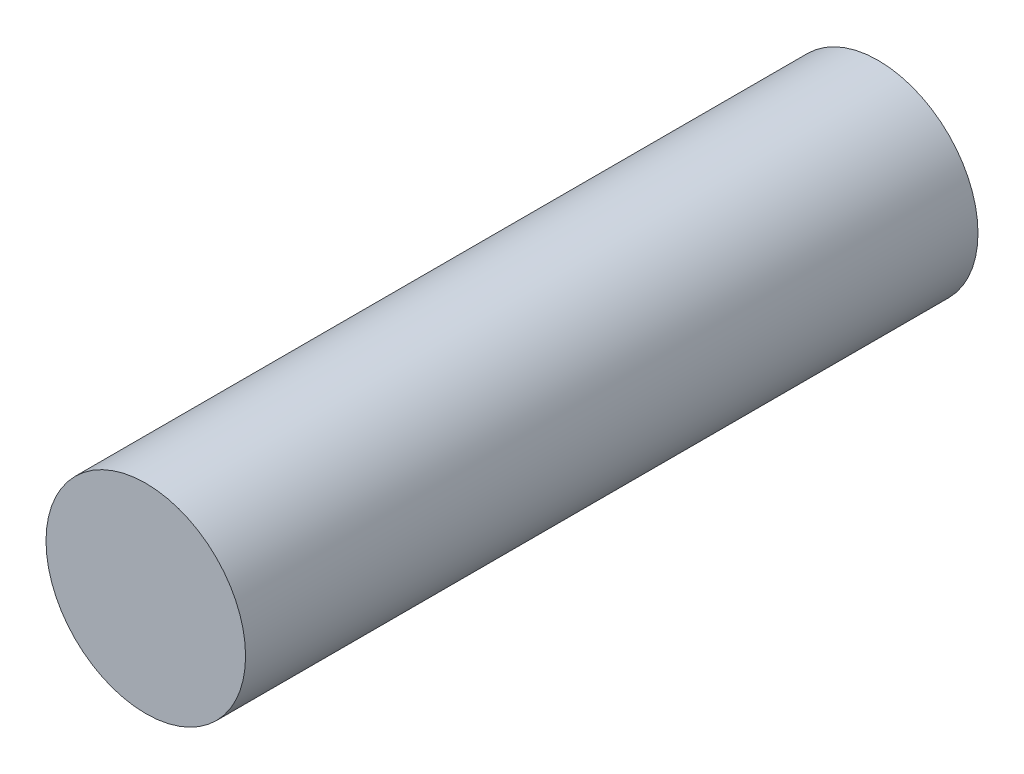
SolidWorks part; units mm, degrees
ref_plane "Front" through (0, 0, 0) normal (0, 0, 1) x (1, 0, 0)
ref_plane "Top" through (0, 0, 0) normal (0, 1, 0) x (1, 0, 0)
ref_plane "Right" through (0, 0, 0) normal (1, 0, 0) x (0, 0, -1)
sketch "Sketch1" plane through (0, 0, 0) normal (0, 0, 1) x (1, 0, 0)
  circle A0 centre (0, 0) radius 2.3876
  dimension "D1" = 4.7752
extrude "Base-Extrude" add sketch "Sketch1" along normal blind 17.526
